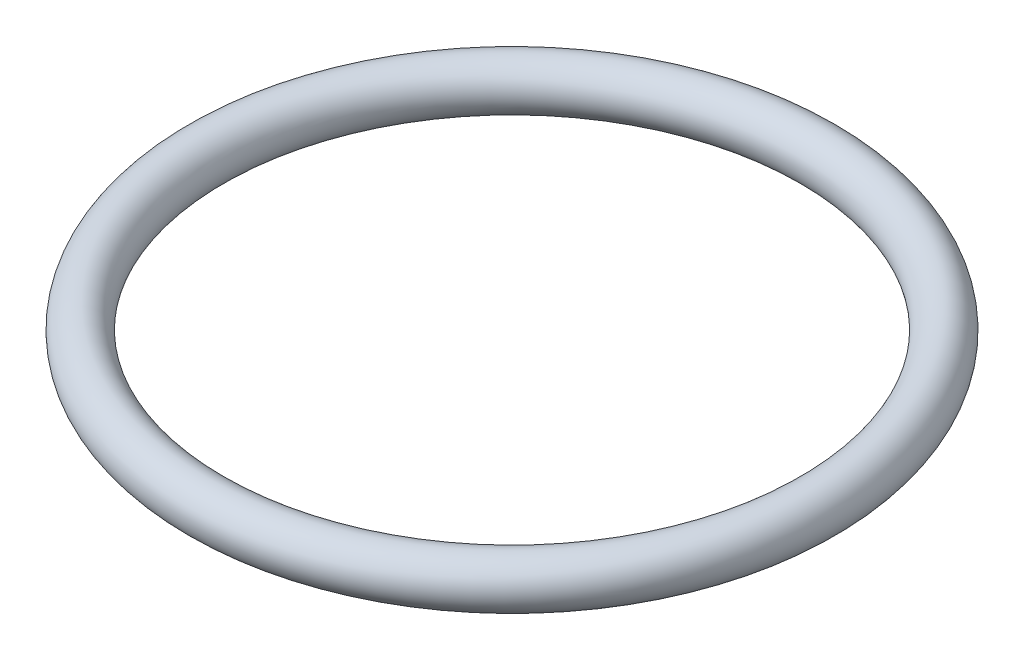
SolidWorks part; units mm, degrees
ref_plane "Front" through (0, 0, 0) normal (0, 0, 1) x (1, 0, 0)
ref_plane "Top" through (0, 0, 0) normal (0, 1, 0) x (1, 0, 0)
ref_plane "Right" through (0, 0, 0) normal (1, 0, 0) x (0, 0, -1)
sketch "Sketch1" plane through (0, 0, 0) normal (0, 0, 1) x (1, 0, 0)
  line L0 (0, 0) -> (0, -14.9294) construction
  circle A0 centre (6.2484, -0.4953) radius 0.4953
  dimension "D1" = 0.9906
  dimension "D2" = 0.4953
  dimension "D3" = 11.5062
revolve "Revolve1" add sketch "Sketch1" angle 360 about L0
